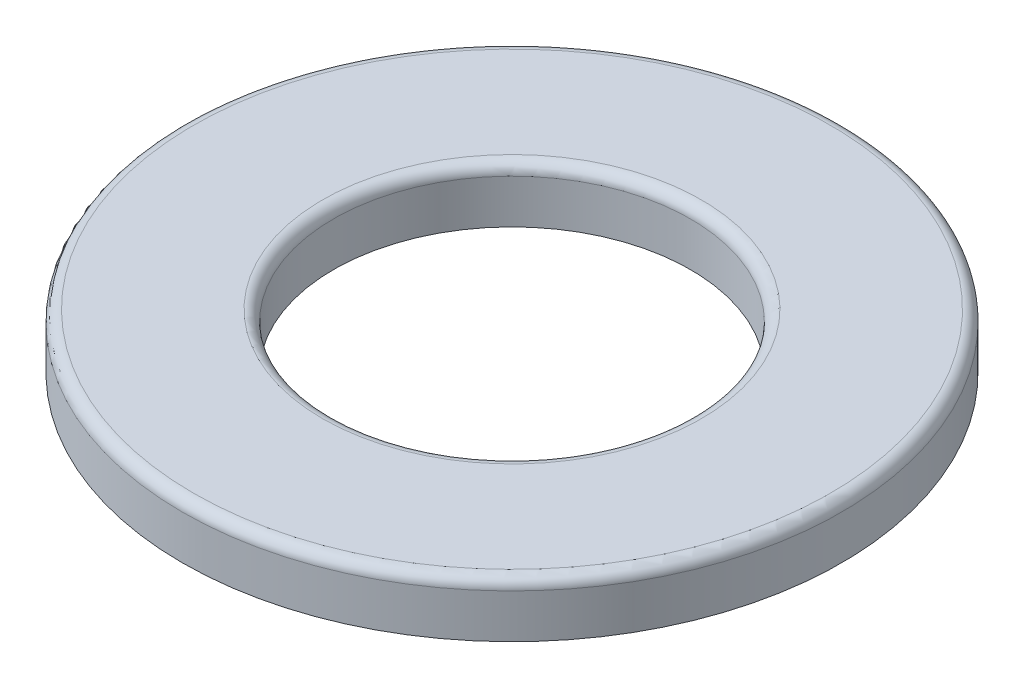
SolidWorks part; units mm, degrees
ref_plane "前视基准面" through (0, 0, 0) normal (0, 0, 1) x (1, 0, 0)
ref_plane "上视基准面" through (0, 0, 0) normal (0, 1, 0) x (1, 0, 0)
ref_plane "右视基准面" through (0, 0, 0) normal (1, 0, 0) x (0, 0, -1)
sketch "草图1" plane through (0, 0, 0) normal (0, 1, 0) x (1, 0, 0)
  circle A0 centre (0, 0) radius 6
  circle A1 centre (0, 0) radius 3.25
  dimension "D1" = 6.5
  dimension "D2" = 12
extrude "凸台-拉伸1" add sketch "草图1" along normal mid plane 1
fillet "圆角1" radius 0.2 2 edges at (0, 0.5, 6) (0, 0.5, 3.25)
